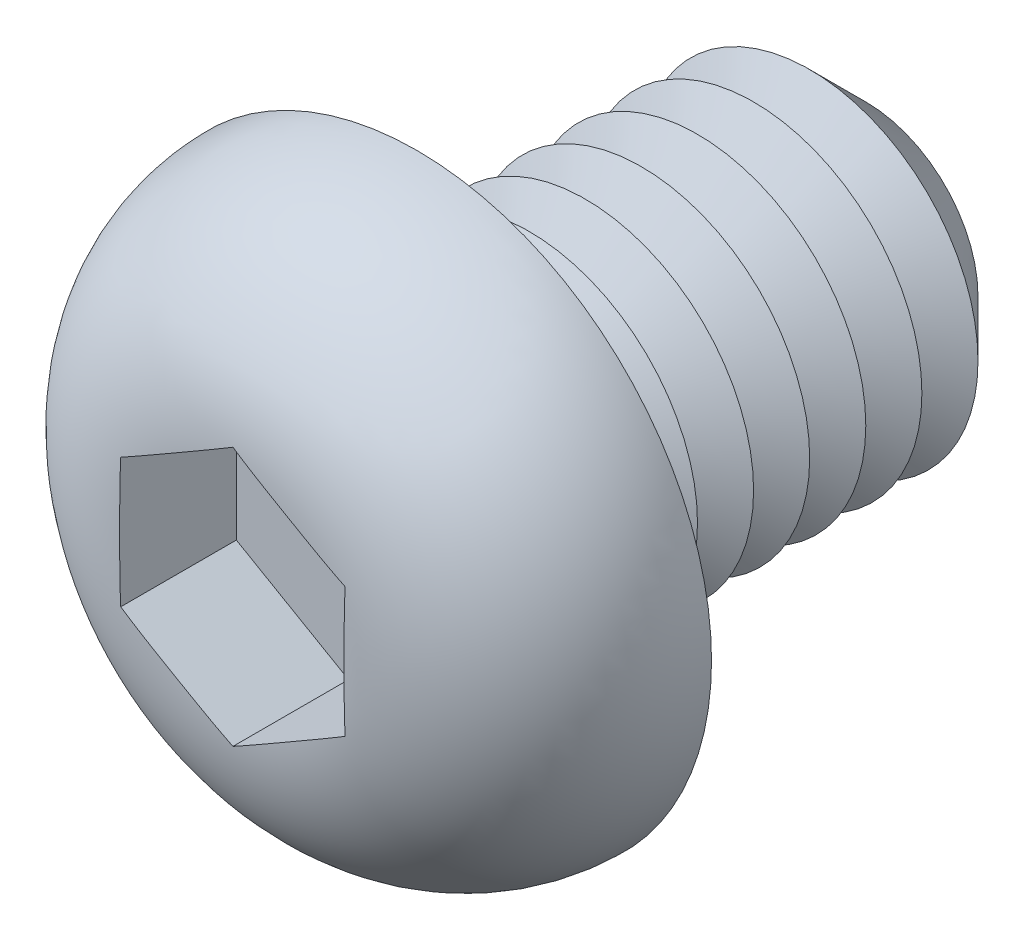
SolidWorks part; units mm, degrees
ref_plane "Front Plane" through (0, 0, 0) normal (0, 0, 1) x (1, 0, 0)
ref_plane "Top Plane" through (0, 0, 0) normal (0, 1, 0) x (1, 0, 0)
ref_plane "Right Plane" through (0, 0, 0) normal (1, 0, 0) x (0, 0, -1)
sketch "Sketch1" plane through (0, 0, 0) normal (1, 0, 0) x (0, 0, -1)
  line L0 (-47.9342, 0) -> (60.3146, 0) construction
sketch "Sketch2" plane through (0, 0, 0) normal (1, 0, 0) x (0, 0, -1)
  line L0 (0, 0) -> (-3.3, 0)
  line L1 (-47.9342, 0) -> (60.3146, 0) construction
  line L2 (-3.3, 0) -> (-3.3, 1.95)
  line L3 (0, 5.25) -> (0, 0)
  arc A0 (-3.3, 1.95) -> (0, 5.25) centre (0, 1.95) cw
  dimension "D1" = 3.3
  dimension "D2" = 3.3
  dimension "D3" = 5.25
revolve "Revolve1" add sketch "Sketch2" angle 360 about L0
sketch "Sketch3" plane through (0, 0, 3.3) normal (0, 0, 1) x (1, 0, 0)
  line L1 (0, 2.3094) -> (-2, 1.1547)
  line L2 (-2, 1.1547) -> (-2, -1.1547)
  line L3 (-2, -1.1547) -> (0, -2.3094)
  line L4 (0, -2.3094) -> (2, -1.1547)
  line L5 (2, -1.1547) -> (2, 1.1547)
  line L6 (2, 1.1547) -> (0, 2.3094)
  circle A0 centre (0, 0) radius 2 construction
  dimension "D1" = 4
extrude "Cut-Extrude1" cut sketch "Sketch3" against normal blind 2.08
sketch "Sketch4" plane through (0, 0, 0) normal (0, 0, -1) x (-1, 0, 0)
  circle A0 centre (0, 0) radius 3
  dimension "D1" = 6
extrude "Boss-Extrude1" add sketch "Sketch4" along normal blind 8
chamfer "Chamfer1" distance 1 angle 45 1 edges at (-3, 0, -8)
sketch "Sketch5" plane through (0, 0, 0) normal (1, 0, 0) x (0, 0, -1)
  line L0 (1, 3) -> (2, 3)
  line L1 (7, 3) -> (0, 3) construction
  line L2 (2, 3) -> (1.5, 2.134)
  line L3 (1.5, 2.134) -> (1, 3)
  line L4 (0, -5.25) -> (0, 5.25) construction
  line L5 (7, 3) -> (0, 3) construction
  dimension "D1" = 1
  dimension "D2" = 1
revolve "Cut-Revolve1" cut sketch "Sketch5" angle 360 about L0
pattern_linear "LPattern1" count 6 spacing 1 along (0, 0, -1) of "Cut-Revolve1"
fillet "Fillet2" radius 0.5 1 edges at (3, 0, 0)
sketch "Sketch6" plane through (0, 0, 1.22) normal (0, 0, 1) x (1, 0, 0)
  circle A0 centre (0, 0) radius 0.8
  dimension "D1" = 1.6
extrude "Cut-Extrude2" cut sketch "Sketch6" against normal up to surface (9.22 mm away)
